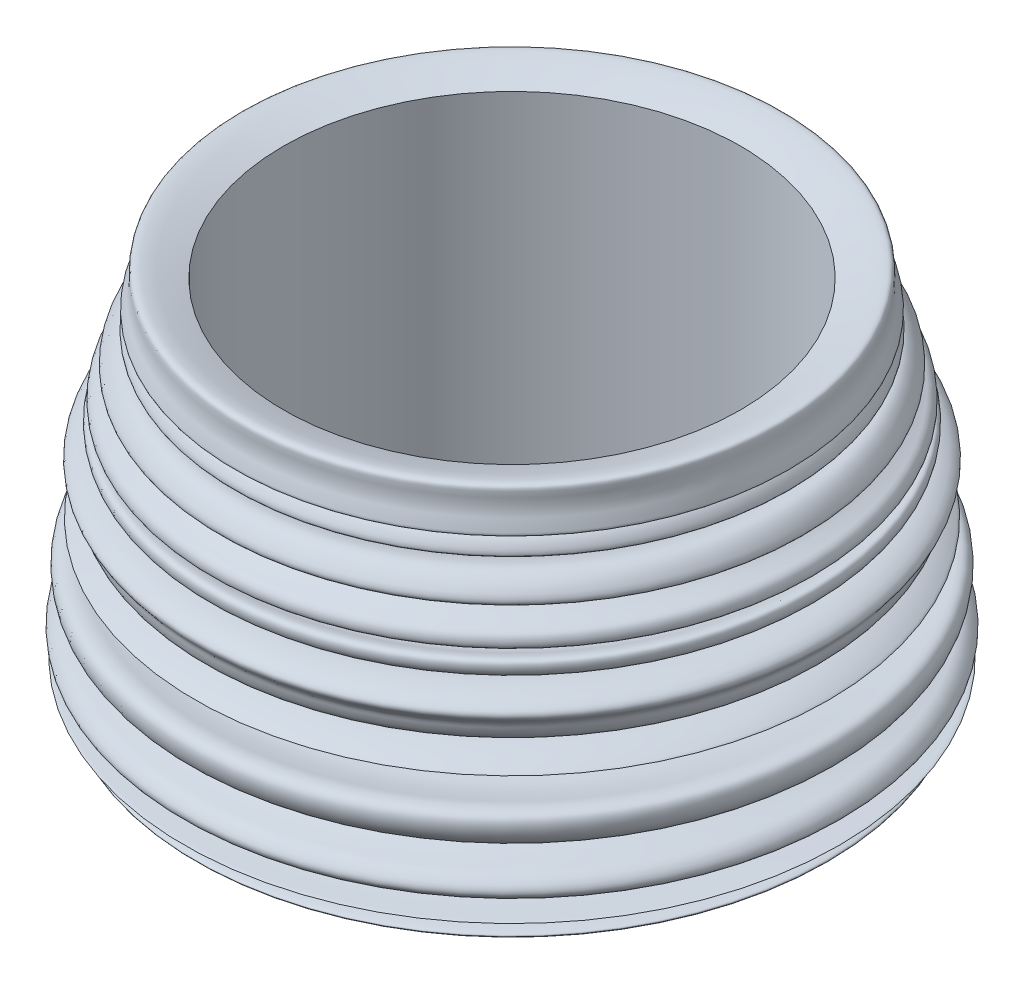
SolidWorks part; units mm, degrees
ref_plane "Front Plane" through (0, 0, 0) normal (0, 0, 1) x (1, 0, 0)
ref_plane "Top Plane" through (0, 0, 0) normal (0, 1, 0) x (1, 0, 0)
ref_plane "Right Plane" through (0, 0, 0) normal (1, 0, 0) x (0, 0, -1)
sketch "Sketch1" plane through (0, 0, 0) normal (0, 0, 1) x (1, 0, 0)
  line L0 (0, 0) -> (0, 203.1317) construction
  line L1 (254, 203.2) -> (254, -203.2)
  line L2 (762, 382.8681) -> (762, -382.8681) construction
  line L3 (0, 0) -> (120.3468, 0) construction
  spline S0 degree 3 poles (254, 203.2) (424.5461, 228.2846) (762, 292.9866) (762, 0) knots 0 0 0 0 1 1 1 1
  spline S1 degree 3 poles (254, -203.2) (424.5461, -228.2846) (762, -292.9866) (762, 0) knots 0 0 0 0 1 1 1 1
  point P5 (254, 0)
  dimension "D1" = 254
  dimension "D2" = 406.4
  dimension "D3" = 762
revolve "Revolve1" [suppressed] add sketch "Sketch1" angle 360 about L0
sketch "Sketch2" plane through (0, 0, 0) normal (0, 0, 1) x (1, 0, 0)
  line L0 (0, 0) -> (0, 304.8988) construction
  line L1 (393.7, 270.6146) -> (393.7, -270.6146) construction
  line L2 (254, 203.2) -> (254, -203.2)
  spline S0 degree 3 number of poles 84 (254, 203.2) -> (254, -203.2)
  point P5 (393.7, 0)
  point P8 (254, 0)
  dimension "D1" = 508
  dimension "D2" = 406.4
  dimension "D3" = 393.7
revolve "Revolve2" add sketch "Sketch2" angle 360 about L0
